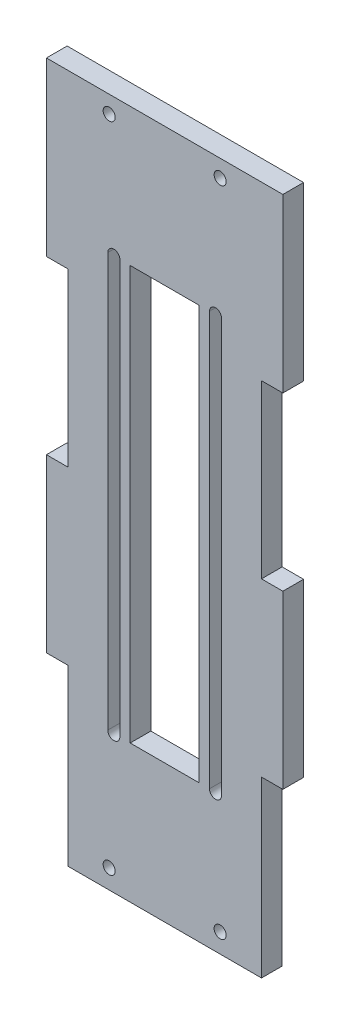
SolidWorks part; units mm, degrees
ref_plane "Alzado" through (0, 0, 0) normal (0, 0, 1) x (1, 0, 0)
ref_plane "Planta" through (0, 0, 0) normal (0, 1, 0) x (1, 0, 0)
ref_plane "Vista lateral" through (0, 0, 0) normal (1, 0, 0) x (0, 0, -1)
sketch "Croquis1" plane through (0, 0, 0) normal (0, 0, 1) x (1, 0, 0)
  line L6 (0, 0) -> (56.2, 0)
  line L10 (0, 0) -> (0, 50.5)
  line L11 (0, 200) -> (56.2, 200)
  line L12 (56.2, 0) -> (56.2, 50.5)
  line L13 (62.4, 50.5) -> (62.4, 100.3)
  line L15 (-6.2, 50.5) -> (-6.2, 100.3)
  line L16 (56.2, 100.3) -> (62.4, 100.3)
  line L17 (56.2, 200) -> (62.4, 200)
  line L19 (56.2, 150.1) -> (62.4, 150.1)
  line L20 (62.4, 200) -> (62.4, 150.1)
  line L21 (56.2, 50.5) -> (62.4, 50.5)
  line L23 (0, 200) -> (-6.2, 200)
  line L24 (-6.2, -6.2) -> (-6.2, 206.2) construction
  line L25 (-6.2, 206.2) -> (62.4, 206.2) construction
  line L26 (62.4, -6.2) -> (62.4, 206.2) construction
  line L28 (28.1, 200) -> (28.1, 154.0206) construction
  line L29 (0, 50.5) -> (-6.2, 50.5)
  line L30 (0, 100.3) -> (-6.2, 100.3)
  line L31 (0, 150.1) -> (-6.2, 150.1)
  line L33 (56.2, 100.3) -> (56.2, 150.1)
  line L34 (56.2, 0) -> (56.2, 200) construction
  line L35 (-6.2, -6.2) -> (62.4, -6.2) construction
  line L36 (-6.2, 150.1) -> (-6.2, 200)
  line L37 (0, 100.3) -> (0, 150.1)
  line L38 (0, 0) -> (0, 200) construction
  line L41 (41.1, 160) -> (41.1, 40)
  line L42 (44.6, 160) -> (44.6, 40)
  line L46 (0, 100.3) -> (12, 100.3) construction
  line L49 (18.1, 160) -> (38.1, 160)
  line L50 (38.1, 160) -> (38.1, 40)
  line L51 (18.1, 40) -> (38.1, 40)
  line L52 (18.1, 160) -> (18.1, 40)
  line L54 (15.1, 160) -> (15.1, 40)
  line L55 (11.6, 160) -> (11.6, 40)
  circle A4 centre (12, 195) radius 1.75
  circle A5 centre (44.2, 195) radius 1.75
  circle A6 centre (12, 5.6) radius 1.75
  circle A7 centre (44.2, 5.6) radius 1.75
  arc A8 (44.6, 40) -> (41.1, 40) centre (42.85, 40) cw
  arc A9 (41.1, 160) -> (44.6, 160) centre (42.85, 160) cw
  arc A10 (15.1, 160) -> (11.6, 160) centre (13.35, 160) ccw
  arc A11 (11.6, 40) -> (15.1, 40) centre (13.35, 40) ccw
  point P5 (28.1, 40)
  dimension "D10" = 40
  dimension "D11" = 20
  dimension "D16" = 3.5
  dimension "D8" = 1.75
  dimension "D1" = 200
  dimension "D2" = 56.2
  dimension "D3" = 6.2
  dimension "D4" = 49.9
  dimension "D5" = 49.8
  dimension "D6" = 49.8
  dimension "D7" = 40
  dimension "D9" = 120
  dimension "D13" = 28.1
  dimension "D14" = 120
  dimension "D17" = 5
  dimension "D18" = 12
extrude "Saliente-Extruir1" add sketch "Croquis1" along normal blind 6
